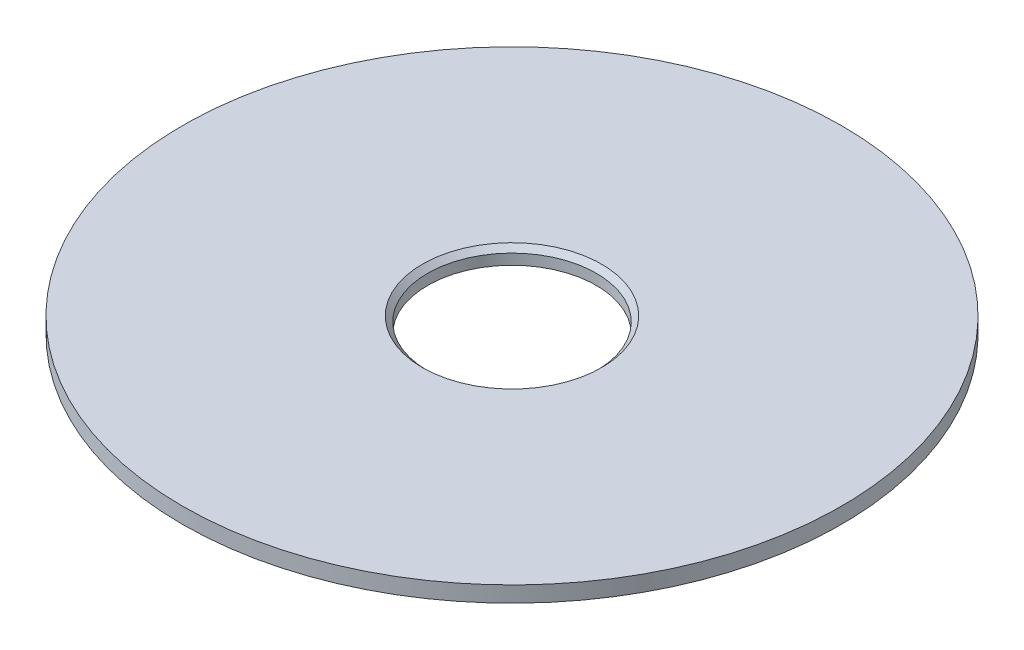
SolidWorks part; units mm, degrees
ref_plane "Front Plane" through (0, 0, 0) normal (0, 0, 1) x (1, 0, 0)
ref_plane "Top Plane" through (0, 0, 0) normal (0, 1, 0) x (1, 0, 0)
ref_plane "Right Plane" through (0, 0, 0) normal (1, 0, 0) x (0, 0, -1)
sketch "Sketch1" plane through (0, 0, 0) normal (0, 1, 0) x (1, 0, 0)
  circle A0 centre (0, 0) radius 31.25
  circle A1 centre (0, 0) radius 8
  circle A2 centre (0, 0) radius 14 construction
  circle A3 centre (0, 0) radius 20 construction
  circle A4 centre (0, 0) radius 26 construction
extrude "Boss-Extrude1" add sketch "Sketch1" against normal blind 1.5
chamfer "Chamfer1" distance 0.5 angle 45 1 edges at (0, 0, 8)
